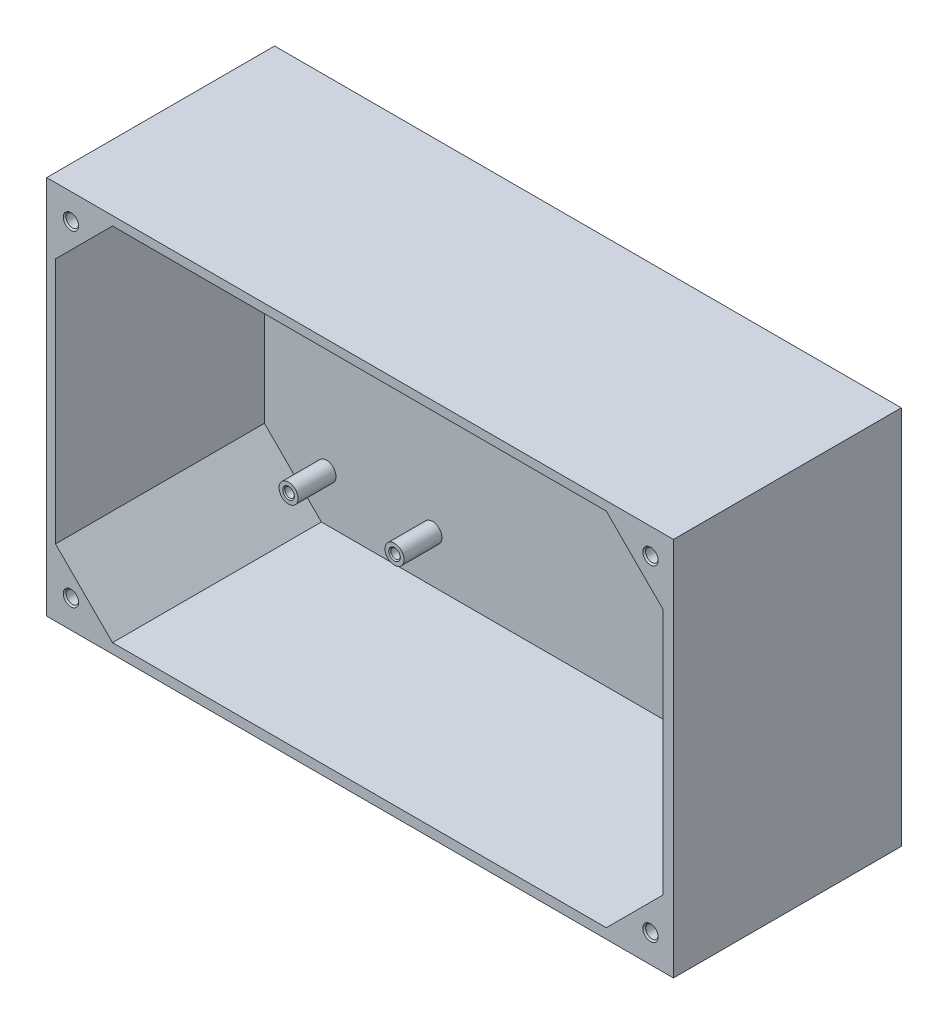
SolidWorks part; units mm, degrees
ref_plane "Ebene vorne" through (0, 0, 0) normal (0, 0, 1) x (1, 0, 0)
ref_plane "Ebene oben" through (0, 0, 0) normal (0, 1, 0) x (1, 0, 0)
ref_plane "Ebene rechts" through (0, 0, 0) normal (1, 0, 0) x (0, 0, -1)
sketch "Skizze2" plane through (0, 0, 0) normal (0, 0, 1) x (1, 0, 0)
  line L1 (-65.9482, 53.3804) -> (99.0518, 53.3804)
  line L2 (-65.9482, 53.3804) -> (-65.9482, -46.6196)
  line L3 (-65.9482, -46.6196) -> (99.0518, -46.6196)
  line L4 (99.0518, 53.3804) -> (99.0518, -46.6196)
  dimension "D1" = 165
  dimension "D2" = 100
extrude "Aufsatz-Linear austragen1" add sketch "Skizze2" along normal blind 60
sketch "Skizze3" plane through (0, 0, 60) normal (0, 0, 1) x (1, 0, 0)
  line L1 (-63.6238, 51.0095) -> (96.3762, 51.0095)
  line L2 (-63.6238, 51.0095) -> (-63.6238, -43.9905)
  line L3 (-63.6238, -43.9905) -> (96.3762, -43.9905)
  line L4 (96.3762, 51.0095) -> (96.3762, -43.9905)
  line L11 (-65.9482, 53.3804) -> (99.0518, -46.6196) construction
  line L12 (99.0518, 53.3804) -> (-65.9482, -46.6196) construction
  line L13 (-63.6238, 51.0095) -> (96.3762, -43.9905) construction
  line L14 (-63.6238, -43.9905) -> (96.3762, 51.0095) construction
  dimension "D1" = 160
  dimension "D2" = 95
extrude "Schnitt-Linear austragen1" cut sketch "Skizze3" against normal blind 55 contours L2 L1 L4 L3
sketch "Skizze4" plane through (0, 0, 5) normal (0, 0, 1) x (1, 0, 0)
  circle A0 centre (-47.2766, -31.7185) radius 2.5
  circle A1 centre (-51.8083, 19.0815) radius 2.5
  circle A2 centre (-3.6083, 19.0815) radius 2.5
  circle A3 centre (-19.3766, -31.7185) radius 2.5
  dimension "D3" = 5
  dimension "D5" = 5
  dimension "D6" = 5
  dimension "D7" = 5
  dimension "D1" = 50.8
  dimension "D2" = 48.2
  dimension "D4" = 27.9
extrude "Aufsatz-Linear austragen2" add sketch "Skizze4" along normal blind 10
hole_wizard "M3 Gewindebohrung1" positions "Skizze5" profile "Skizze6" tap size "M3" standard "DIN"
sketch "Skizze5" plane through (0, 0, 15) normal (0, 0, 1) x (1, 0, 0)
  point P0 (-51.8083, 19.0815)
  point P3 (-3.6083, 19.0815)
  point P6 (-19.3766, -31.7185)
  point P9 (-47.2766, -31.7185)
sketch "Skizze6" plane through (-51.8083, 19.0815, 15) normal (1, 0, 0) x (0, -1, 0)
  line L0 (0, 0) -> (0, 10.7511)
  line L1 (0, 10.7511) -> (1.25, 10)
  line L2 (1.25, 10) -> (1.25, 0.275)
  line L3 (1.25, 0.275) -> (1.525, 0)
  line L5 (1.525, 0) -> (0, 0)
  line L6 (-1.25, 0.275) -> (-1.525, 0) construction
  line L10 (0, 10.7511) -> (-1.25, 10) construction
  line L11 (0, -6.35) -> (0, 107.95) construction
  dimension "Bohrerdurchmesser" = 2.5
  dimension "Bohrungstiefe" = 10
  dimension "Senkdurchmesser (Oben)" = 3.05
  dimension "Senkwinkel (Oben)" = 90
  dimension "Spitzenwinkel" = 118
sketch "Skizze12" plane through (0, 0, 5) normal (0, 0, 1) x (1, 0, 0)
  line L0 (96.3762, 51.0095) -> (96.3762, -43.9905) construction
  line L1 (96.3762, 14.9856) -> (77.1762, 14.9856)
  line L2 (96.3762, 14.9856) -> (96.3762, -0.6144)
  line L3 (96.3762, -0.6144) -> (77.1762, -0.6144)
  line L4 (77.1762, 14.9856) -> (77.1762, -0.6144)
  dimension "D1" = 19.2
  dimension "D2" = 15.6
extrude "Aufsatz-Linear austragen4" add sketch "Skizze12" along normal blind 20
sketch "Skizze13" plane through (0, 0, 25) normal (0, 0, 1) x (1, 0, 0)
  line L1 (77.7341, 14.5046) -> (95.7775, 14.5046)
  line L2 (77.7341, 14.5046) -> (77.7341, 0)
  line L3 (77.7341, 0) -> (95.7775, 0)
  line L4 (95.7775, 14.5046) -> (95.7775, 0)
extrude "Schnitt-Linear austragen5" cut sketch "Skizze13" against normal blind 17
sketch "Skizze14" plane through (77.1762, 0, 0) normal (-1, 0, 0) x (0, 0, 1)
  line L1 (5.7539, 14.0529) -> (8.8382, 14.0529)
  line L2 (5.7539, 14.0529) -> (5.7539, 0.3969)
  line L3 (5.7539, 0.3969) -> (8.8382, 0.3969)
  line L4 (8.8382, 14.0529) -> (8.8382, 0.3969)
extrude "Schnitt-Linear austragen6" cut sketch "Skizze14" against normal blind 18
fillet "Verrundung2" radius 15 1 edges at (-63.6238, 51.0095, 32.5)
fillet "Fase1" radius 15 3 edges at (-63.6238, -43.9905, 32.5) (96.3762, -43.9905, 32.5) (96.3762, 51.0095, 32.5)
hole_wizard "M4 Gewindebohrung1" positions "Skizze17" profile "Skizze18" tap size "M4" standard "DIN"
sketch "Skizze17" plane through (0, 0, 60) normal (0, 0, 1) x (1, 0, 0)
  point P0 (-59.5644, 46.5585)
  point P3 (93.0093, 46.5585)
  point P5 (93.0093, -39.2856)
  point P7 (-59.5644, -39.2856)
sketch "Skizze18" plane through (-59.5644, 46.5585, 60) normal (1, 0, 0) x (0, -1, 0)
  line L0 (0, 0) -> (0, 55.9914)
  line L1 (0, 55.9914) -> (1.65, 55)
  line L2 (1.65, 55) -> (1.65, 0.375)
  line L3 (1.65, 0.375) -> (2.025, 0)
  line L5 (2.025, 0) -> (0, 0)
  line L6 (-1.65, 0.375) -> (-2.025, 0) construction
  line L10 (0, 55.9914) -> (-1.65, 55) construction
  line L11 (0, -6.35) -> (0, 107.95) construction
  dimension "Bohrerdurchmesser" = 3.3
  dimension "Bohrungstiefe" = 55
  dimension "Senkdurchmesser (Oben)" = 4.05
  dimension "Senkwinkel (Oben)" = 90
  dimension "Spitzenwinkel" = 118
